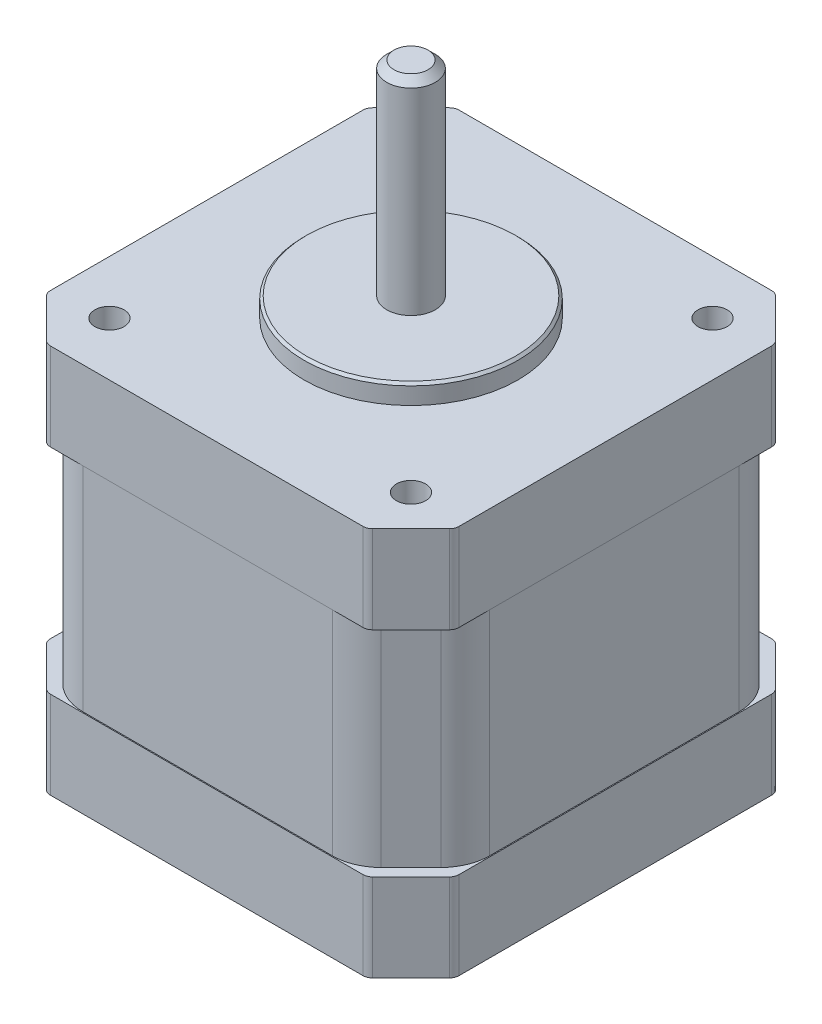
SolidWorks part; units mm, degrees
ref_plane "Front Plane" through (0, 0, 0) normal (0, 0, 1) x (1, 0, 0)
ref_plane "Top Plane" through (0, 0, 0) normal (0, 1, 0) x (1, 0, 0)
ref_plane "Right Plane" through (0, 0, 0) normal (1, 0, 0) x (0, 0, -1)
sketch "Sketch1" plane through (0, 0, 0) normal (0, 1, 0) x (1, 0, 0)
  line L0 (-16.4767, 21) -> (-21, 16.4767)
  line L1 (16.4767, -21) -> (-16.4767, -21)
  line L2 (21, -16.4767) -> (21, 16.4767)
  line L3 (16.4767, 21) -> (-16.4767, 21)
  line L4 (-21, -16.4767) -> (-21, 16.4767)
  line L5 (21, -21) -> (-21, 21) construction
  line L6 (21, 21) -> (-21, -21) construction
  line L7 (21, 16.4767) -> (16.4767, 21)
  line L8 (21, -16.4767) -> (16.4767, -21)
  line L9 (-16.4767, -21) -> (-21, -16.4767)
  point P0 (0, 0)
  dimension "D1" = 42
  dimension "D2" = 42
  dimension "D3" = 53
extrude "Boss-Extrude1" add sketch "Sketch1" along normal blind 9
sketch "Sketch2" plane through (0, 9, 0) normal (0, 1, 0) x (1, 0, 0)
  line L1 (14.9, -20.9) -> (-14.9, -20.9)
  line L2 (20.9, -14.9) -> (20.9, 14.9)
  line L3 (14.9, 20.9) -> (-14.9, 20.9)
  line L4 (-20.9, -14.9) -> (-20.9, 14.9)
  line L5 (20.9, -20.9) -> (-20.9, 20.9) construction
  line L6 (20.9, 20.9) -> (-20.9, -20.9) construction
  line L8 (-14.9, 20.9) -> (-20.9, 14.9)
  line L9 (20.9, 14.9) -> (14.9, 20.9)
  line L10 (20.9, -14.9) -> (14.9, -20.9)
  line L11 (-14.9, -20.9) -> (-20.9, -14.9)
  line L15 (-21, 16.4767) -> (-21, -16.4767) construction
  line L16 (-16.4767, -21) -> (16.4767, -21) construction
  point P0 (0, 0)
  dimension "D2" = 0.1
  dimension "D3" = 0.1
extrude "Boss-Extrude4" add sketch "Sketch2" along normal blind 22
sketch "Sketch4" plane through (0, 31, 0) normal (0, 1, 0) x (1, 0, 0)
  line L0 (16.4767, 21) -> (-16.4767, 21) construction
  line L1 (16.4767, -21) -> (-16.4767, -21)
  line L2 (21, -16.4767) -> (21, 16.4767)
  line L3 (16.4767, 21) -> (-16.4767, 21)
  line L4 (-21, -16.4767) -> (-21, 16.4767)
  line L5 (21, -21) -> (-21, 21) construction
  line L6 (21, 21) -> (-21, -21) construction
  line L7 (-21, 16.4767) -> (-21, -16.4767) construction
  line L8 (-16.4767, 21) -> (-21, 16.4767)
  line L9 (21, 16.4767) -> (16.4767, 21)
  line L10 (21, -16.4767) -> (16.4767, -21)
  line L11 (-16.4767, -21) -> (-21, -16.4767)
  line L12 (-16.4767, 21) -> (-21, 16.4767) construction
  line L13 (-21, -16.4767) -> (-16.4767, -21) construction
  line L14 (16.4767, -21) -> (21, -16.4767) construction
  line L15 (21, 16.4767) -> (16.4767, 21) construction
  point P0 (0, 0)
extrude "Boss-Extrude5" add sketch "Sketch4" along normal blind 9
sketch "Sketch5" plane through (0, 40, 0) normal (0, 1, 0) x (1, 0, 0)
  circle A0 centre (0, 0) radius 11
  dimension "D1" = 22
extrude "Boss-Extrude6" add sketch "Sketch5" along normal blind 2
chamfer "Chamfer1" distance 0.25 angle 45 1 edges at (0, 42, 11)
sketch "Sketch6" plane through (0, 42, 0) normal (0, 1, 0) x (1, 0, 0)
  circle A0 centre (0, 0) radius 2.5
  dimension "D1" = 5
extrude "Boss-Extrude7" add sketch "Sketch6" along normal blind 21
chamfer "Chamfer2" distance 0.75 angle 45 1 edges at (0, 63, 2.5)
fillet "Fillet2" radius 1 16 edges at (16.4767, 4.5, -21) (21, 4.5, -16.4767) (21, 4.5, 16.4767) (16.4767, 4.5, 21) (-16.4767, 4.5, 21) (-21, 4.5, 16.4767) (-16.4767, 4.5, -21) (-21, 4.5, -16.4767) (-16.4767, 35.5, -21) (-21, 35.5, -16.4767) (16.4767, 35.5, -21) (21, 35.5, -16.4767) (21, 35.5, 16.4767) (16.4767, 35.5, 21) (-16.4767, 35.5, 21) (-21, 35.5, 16.4767)
fillet "Fillet3" radius 5 8 edges at (-14.9, 20, 20.9) (-20.9, 20, 14.9) (-20.9, 20, -14.9) (-14.9, 20, -20.9) (14.9, 20, -20.9) (20.9, 20, -14.9) (20.9, 20, 14.9) (14.9, 20, 20.9)
sketch "Sketch7" plane through (0, 0, 0) normal (0, -1, 0) x (1, 0, 0)
  circle A0 centre (0, 0) radius 4.5
  dimension "D1" = 9
extrude "Cut-Extrude1" cut sketch "Sketch7" against normal blind 3
sketch "Sketch8" plane through (0, 40, 0) normal (0, 1, 0) x (1, 0, 0)
  line L1 (15.5, 15.5) -> (-15.5, 15.5) construction
  line L2 (15.5, 15.5) -> (15.5, -15.5) construction
  line L3 (15.5, -15.5) -> (-15.5, -15.5) construction
  line L4 (-15.5, 15.5) -> (-15.5, -15.5) construction
  line L5 (15.5, 15.5) -> (-15.5, -15.5) construction
  line L6 (15.5, -15.5) -> (-15.5, 15.5) construction
  circle A0 centre (-15.5, -15.5) radius 1.5
  circle A1 centre (-15.5, 15.5) radius 1.5
  circle A2 centre (15.5, 15.5) radius 1.5
  circle A3 centre (15.5, -15.5) radius 1.5
  point P0 (0, 0)
  dimension "D3" = 3
  dimension "D4" = 3
  dimension "D5" = 3
  dimension "D6" = 3
  dimension "D1" = 31
  dimension "D2" = 31
extrude "Cut-Extrude2" cut sketch "Sketch8" against normal through all
sketch "Sketch9" plane through (0, 0, 0) normal (0, -1, 0) x (1, 0, 0)
  circle A0 centre (-15.5, 15.5) radius 3
  circle A1 centre (15.5, 15.5) radius 3
  circle A2 centre (-15.5, -15.5) radius 3
  circle A3 centre (15.5, -15.5) radius 3
  dimension "D1" = 6
  dimension "D2" = 6
  dimension "D3" = 6
  dimension "D4" = 6
extrude "Cut-Extrude3" cut sketch "Sketch9" against normal blind 1.3
